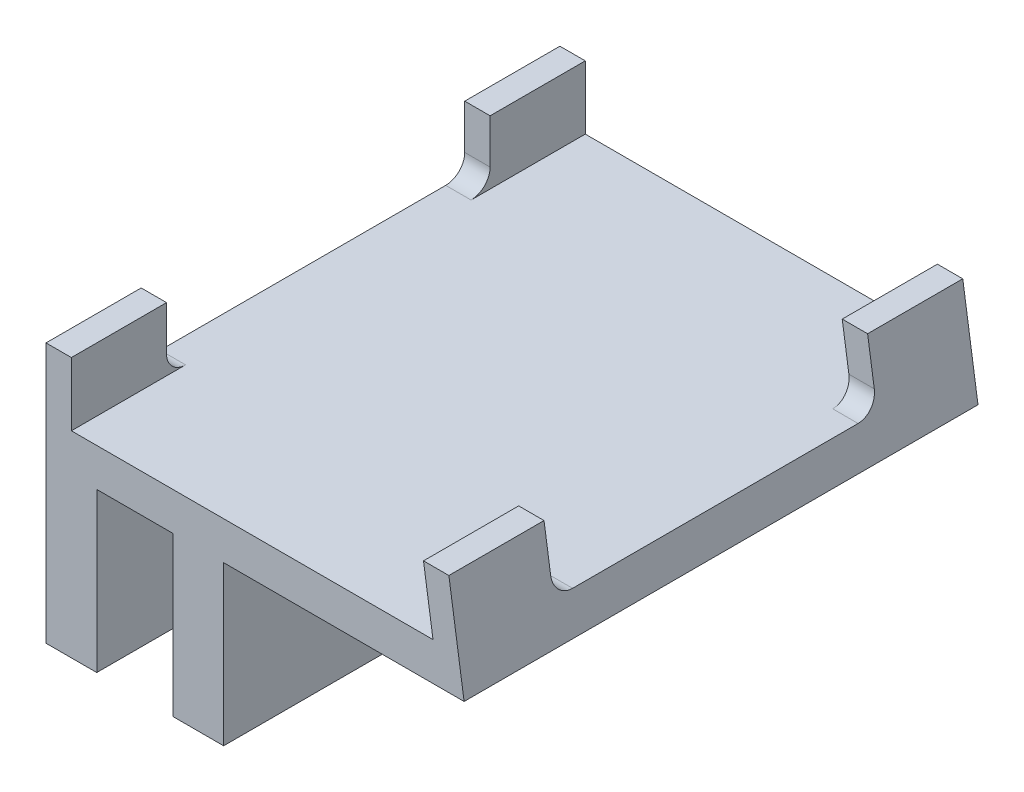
SolidWorks part; units mm, degrees
ref_plane "Front Plane" through (0, 0, 0) normal (0, 0, 1) x (1, 0, 0)
ref_plane "Top Plane" through (0, 0, 0) normal (0, 1, 0) x (1, 0, 0)
ref_plane "Right Plane" through (0, 0, 0) normal (1, 0, 0) x (0, 0, -1)
sketch "Esquisse1" plane through (0, 0, 0) normal (0, 0, 1) x (1, 0, 0)
  line L0 (-4, 10) -> (-4, -31)
  line L1 (-4, -31) -> (4, -31)
  line L2 (4, -31) -> (4, -6)
  line L3 (4, -6) -> (16, -6)
  line L4 (16, -6) -> (16, -31)
  line L5 (16, -31) -> (24, -31)
  line L6 (24, -31) -> (24, -6)
  line L7 (24, -6) -> (61.9, -6)
  line L8 (61.9, -6) -> (59.5, 10)
  line L9 (55.5, 10) -> (57, 0)
  line L10 (55.5, 10) -> (59.5, 10)
  line L11 (57, 0) -> (0, 0)
  line L12 (0, 0) -> (0, 10)
  line L13 (0, 10) -> (-4, 10)
  point P19 (42.95, -6)
  dimension "D1" = 8
  dimension "D2" = 25
  dimension "D3" = 12
  dimension "D4" = 25
  dimension "D5" = 6
  dimension "D6" = 10
  dimension "D7" = 57
  dimension "D8" = 1.5
  dimension "D9" = 4
extrude "Boss.-Extru.1" add sketch "Esquisse1" along normal mid plane 81
sketch "Esquisse2" plane through (-4, 0, 0) normal (-1, 0, 0) x (0, 0, 1)
  line L0 (40.5, 10) -> (-40.5, 10) construction
  line L1 (-25.5, 10) -> (25.5, 10)
  line L2 (-25.5, 10) -> (-25.5, 3)
  line L3 (-22.5, 0) -> (22.5, 0)
  line L4 (25.5, 10) -> (25.5, 3)
  line L5 (-40.5, 10) -> (-40.5, -31) construction
  arc A0 (-25.5, 3) -> (-22.5, 0) centre (-22.5, 3) ccw
  arc A1 (22.5, 0) -> (25.5, 3) centre (22.5, 3) ccw
  point P1 (0, 0)
  dimension "D2" = 3
  dimension "D1" = 15
extrude "Enlèv. mat.-Extru.1" cut sketch "Esquisse2" against normal through all
sketch "Esquisse3" plane through (24, 0, 0) normal (1, 0, 0) x (0, 0, -1)
  line L1 (-40.5, -31) -> (-40.5, -6) construction
  circle A0 centre (0, -18.5) radius 4.525
  point P6 (-40.5, -18.5)
  dimension "D1" = 9.05
extrude "Enlèv. mat.-Extru.2" cut sketch "Esquisse3" against normal up to next
thread "Filetage1" pitch 1.5 start angle 0, offset 2, length 0, pitch 1.5, diameter 9.05
ref_plane "Plan1" through (26, -18.5, 4.525) normal (0, -1, 0) x (0, 0, 1)
sketch "Profil de filetage1" plane through (26, -18.5, 4.525) normal (0, -1, 0) x (0, 0, 1)
  line L0 (0, 0) -> (0, 1.5) construction
  line L11 (0, 1.3125) -> (0, 0)
  line L12 (0, 0) -> (0.8119, 0.4688)
  line L13 (0.8119, 0.4688) -> (0.8119, 0.8438)
  line L15 (0.8119, 0.8438) -> (0, 1.3125)
  line L17 (0.8119, 0.6563) -> (0, 0.6563) construction
  point P3 (0, 0)
  dimension "Pitch" = 1.5
  dimension "Profile_Angle" = 60
  dimension "Profile_Land" = 0.375
  dimension "Profile_Height" = 0.8119
